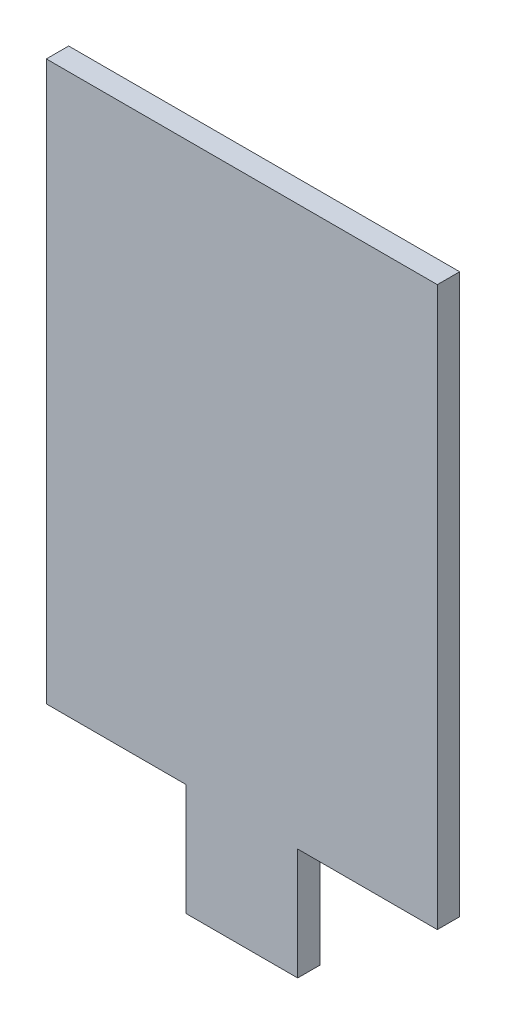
SolidWorks part; units mm, degrees
ref_plane "정면" through (0, 0, 0) normal (0, 0, 1) x (1, 0, 0)
ref_plane "윗면" through (0, 0, 0) normal (0, 1, 0) x (1, 0, 0)
ref_plane "우측면" through (0, 0, 0) normal (1, 0, 0) x (0, 0, -1)
sketch "스케치1" plane through (0, 0, 0) normal (0, 0, 1) x (1, 0, 0)
  line L1 (-14, -20) -> (-4, -20)
  line L2 (-14, -20) -> (-14, 20)
  line L3 (-14, 20) -> (14, 20)
  line L4 (14, -20) -> (14, 20)
  line L5 (-14, -20) -> (14, 20) construction
  line L6 (-14, 20) -> (14, -20) construction
  line L7 (4, -28) -> (-4, -28)
  line L8 (-4, -28) -> (-4, -20)
  line L9 (14, -20) -> (4, -20)
  line L10 (4, -20) -> (4, -28)
  point P0 (0, 0)
  point P11 (0, -28)
  dimension "D1" = 28
  dimension "D2" = 48
  dimension "D3" = 8
  dimension "D5" = 8
extrude "보스-돌출1" add sketch "스케치1" along normal blind 1.6
